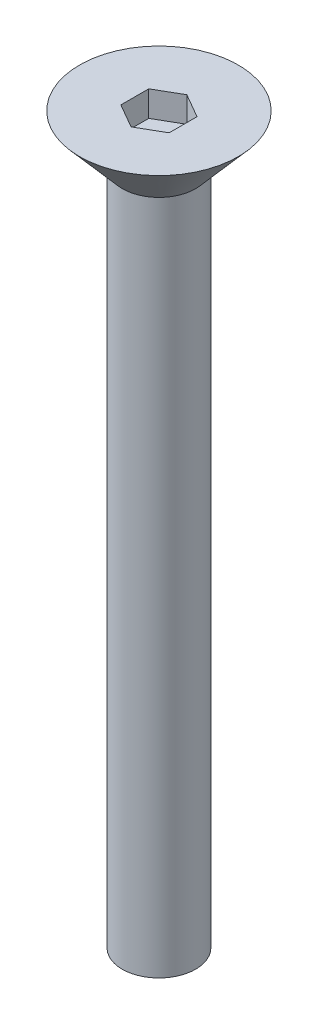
SolidWorks part; units mm, degrees
revolve "Screw" add sketch "Sketch1" angle 360 about L5
sketch "Sketch1" plane through (0, 0, 0) normal (0, 0, 1) x (1, 0, 0)
  line L0 (0, 0) -> (5.2197, 0)
  line L1 (2.413, -3.2287) -> (5.2197, 0)
  line L4 (2.413, -3.2287) -> (2.413, -47.6787)
  line L5 (0, 25.4) -> (0, -50.8) construction
  line L6 (2.413, -47.6787) -> (0, -47.6787)
  line L7 (0, 0) -> (0, -47.6787)
ref_plane "Plane1" through (0, 0, 0) normal (0, 0, 1) x (1, 0, 0)
ref_plane "Plane2" through (0, 0, 0) normal (0, 1, 0) x (1, 0, 0)
ref_plane "Plane3" through (0, 0, 0) normal (1, 0, 0) x (0, 0, -1)
sketch "Sketch2" plane through (0, 0, 0) normal (0, 1, 0) x (-1, 0, 0)
  line L0 (0, -5.08) -> (0, 5.08) construction
  line L1 (24.4475, 0) -> (-27.6225, 0) construction
  line L2 (-1.5875, -0.9165) -> (-1.5875, 0.9165)
  line L3 (0, 1.8331) -> (-1.5875, 0.9165)
  line L4 (0, 1.8331) -> (1.5875, 0.9165)
  line L5 (1.5875, -0.9165) -> (1.5875, 0.9165)
  line L6 (0, -1.8331) -> (-1.5875, -0.9165)
  line L7 (0, -1.8331) -> (1.5875, -0.9165)
  point P8 (-1.5875, 0)
  dimension "D1" = 120
  dimension "HexWidth" = 3.175
extrude "HexCut" cut sketch "Sketch2" against normal blind 1.684
sketch "Sketch3" plane through (0, 0, 0) normal (0, 0, 1) x (1, 0, 0)
  line L0 (0, -30.353) -> (0, -38.481) construction
  line L1 (0, 25.4) -> (0, -50.8) construction
  line L2 (1.8986, -31.623) -> (1.8987, -39.624) construction
  line L3 (2.413, -47.6787) -> (2.413, -3.2287) construction
  line L4 (2.413, -47.6787) -> (2.413, -47.1465)
  line L5 (-2.413, -47.6787) -> (2.413, -47.6787) construction
  line L6 (1.8987, -47.6787) -> (2.413, -47.6787)
  line L7 (1.8987, -47.6787) -> (2.413, -47.1465)
revolve "Thread1" [suppressed] cut sketch "Sketch3" angle 360 about L0
sketch "Sketch4" [suppressed] plane through (0, 0, 0) normal (0, 0, 1) x (1, 0, 0)
  line L0 (13.2367, -207.6893) -> (2.3704, -207.6893) construction
  line L1 (3.9688, -207.6893) -> (-3.9688, -207.6893) construction
  line L2 (3.4544, -207.1601) -> (3.9688, -207.6893)
  line L3 (3.9688, -208.2184) -> (3.9688, -207.6893)
  line L4 (3.4544, -208.2184) -> (3.9688, -207.6893)
  line L5 (3.4544, -208.2184) -> (3.9688, -208.2184)
  line L6 (3.9688, -208.2184) -> (3.9688, -207.1601) construction
  line L7 (3.4544, -208.2184) -> (3.9688, -207.6893) construction
  line L8 (3.4544, -208.2184) -> (3.9688, -208.2184) construction
  line L9 (3.4544, -207.1601) -> (3.9688, -207.1601)
  line L10 (3.9688, -207.1601) -> (3.9688, -207.6893)
  line L11 (0, -31.5484) -> (0, -39.4318) construction
  line L12 (0, 25.4) -> (0, -50.8) construction
  point P9 (3.9688, -207.6893)
  dimension "D1" = 0
revolve "Thread2" [suppressed] cut sketch "Sketch4" angle 360 about L11
pattern_linear "Threads" [suppressed]
equation "\"HexDepth@HexCut\" =  ( \"HeadWidth@Sketch1\" - \"NominalDia@Sketch1\" )  *  .3"
equation "\"ThreadWidth@Threads\" =\"ThreadWidth@Sketch3\"  * 2"
